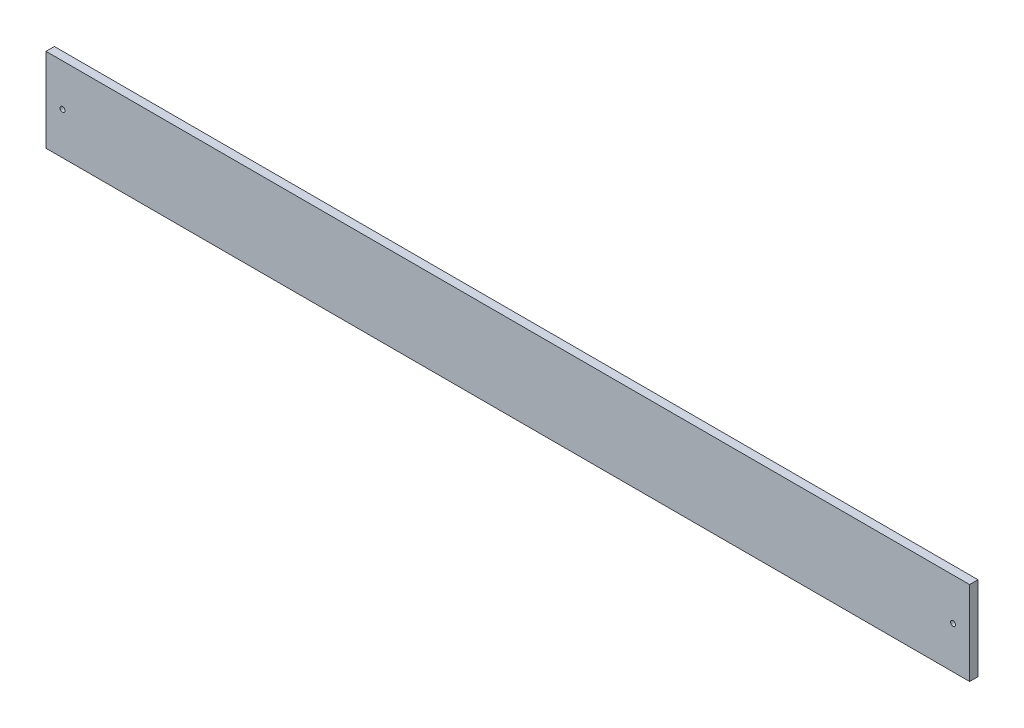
SolidWorks part; units mm, degrees
ref_plane "Front Plane" through (0, 0, 0) normal (0, 0, 1) x (1, 0, 0)
ref_plane "Top Plane" through (0, 0, 0) normal (0, 1, 0) x (1, 0, 0)
ref_plane "Right Plane" through (0, 0, 0) normal (1, 0, 0) x (0, 0, -1)
sketch "Sketch1" plane through (0, 0, 0) normal (0, 0, 1) x (1, 0, 0)
  line L1 (-275, 25) -> (275, 25)
  line L2 (-275, 25) -> (-275, -25)
  line L3 (-275, -25) -> (275, -25)
  line L4 (275, 25) -> (275, -25)
  line L5 (-275, 25) -> (275, -25) construction
  line L6 (-275, -25) -> (275, 25) construction
  point P0 (0, 0)
  dimension "D1" = 550
  dimension "D2" = 50
extrude "Boss-Extrude1" add sketch "Sketch1" along normal blind 5
sketch "Sketch2" plane through (0, 0, 5) normal (0, 0, 1) x (1, 0, 0)
  circle A0 centre (265.165, 0) radius 1.5
  dimension "D1" = 3
  dimension "D2" = 265.165
extrude "Cut-Extrude1" cut sketch "Sketch2" against normal blind 5
mirror "Mirror1" about plane through (0, 0, 0) normal (1, 0, 0) of "Cut-Extrude1"
